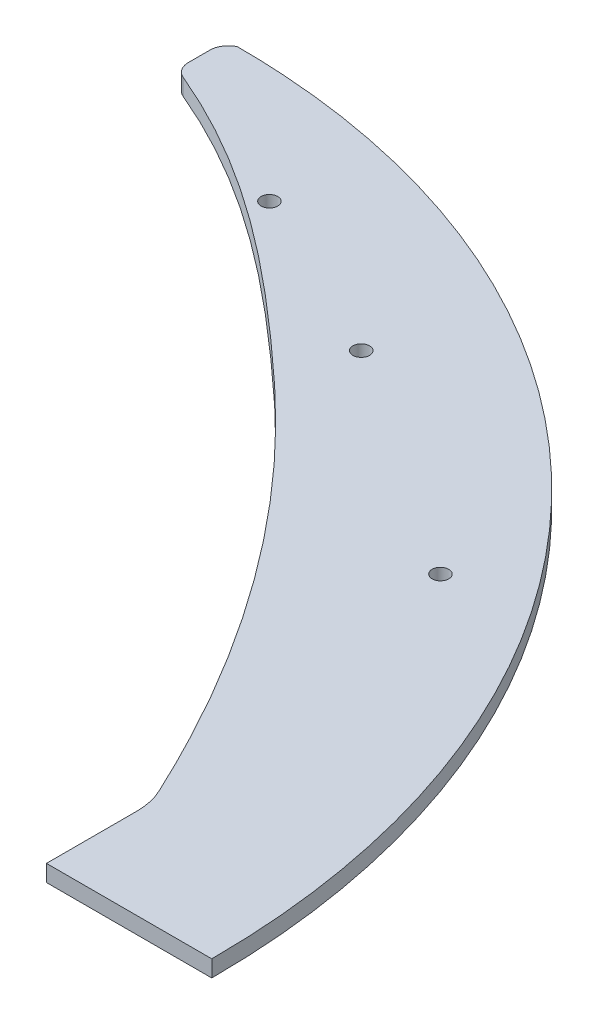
SolidWorks part; units mm, degrees
ref_plane "Front Plane" through (0, 0, 0) normal (0, 0, 1) x (1, 0, 0)
ref_plane "Top Plane" through (0, 0, 0) normal (0, 1, 0) x (1, 0, 0)
ref_plane "Right Plane" through (0, 0, 0) normal (1, 0, 0) x (0, 0, -1)
sketch "Sketch1" plane through (0, 0, 0) normal (0, 1, 0) x (1, 0, 0)
  line L0 (-50.4146, 9.1774) -> (-50.4146, -25.4031)
  line L1 (-288.2827, 266.6706) -> (-288.2827, 274.9943)
  line L2 (-50.4146, -25.4031) -> (-12.6572, -25.4031)
  line L7 (-12.6572, -25.4031) -> (12.7502, -25.4031)
  arc A0 (-286.2737, 279.6287) -> (-288.2827, 274.9943) centre (-281.9327, 274.9943) ccw
  arc A1 (-284.3932, 260.8167) -> (-288.2827, 266.6706) centre (-281.9327, 266.6706) cw
  arc A2 (-50.4146, 9.1774) -> (-52.7979, 19.9194) centre (-75.8146, 9.1774) ccw
  ellipse E0 centre (-284.3932, -25.4031) end of major axis (-284.3932, 281.299) minor radius 297.1434 (-284.3932, 281.299) -> (12.7502, -25.4031) cw
  spline S1 degree 3 poles (-52.7979, 19.9194) (-79.0996, 76.2756) (-119.6631, 134.816) (-201.5343, 210.0495) (-243.7298, 243.7252) (-284.3932, 260.8167) knots 0.015453 0.015453 0.015453 0.015453 0.526895 0.62426 0.989096 0.989096 0.989096 0.989096
  spline S2 degree 3 poles (-284.3932, 281.299) (-285.0216, 280.7709) (-285.6485, 280.2143) (-286.2737, 279.6287) knots 0.92326 0.92326 0.92326 0.92326 0.930191 0.930191 0.930191 0.930191
  dimension "D2" = 25.4
  dimension "D1" = 6.35
extrude "Extrude1" add sketch "Sketch1" along normal blind 6.35
sketch "Sketch2" plane through (0, 6.35, 0) normal (0, 1, 0) x (1, 0, 0)
  circle A0 centre (2.4252, 82.2079) radius 3.1813
  circle A1 centre (-279.3791, 253.1267) radius 3.1814
  circle A3 centre (-70.8638, 145.5786) radius 3.1814
  circle A5 centre (-159.9364, 204.3864) radius 3.1814
  circle A7 centre (-226.8919, 236.2558) radius 3.1814
extrude "Extrude2" cut sketch "Sketch2" against normal through all
